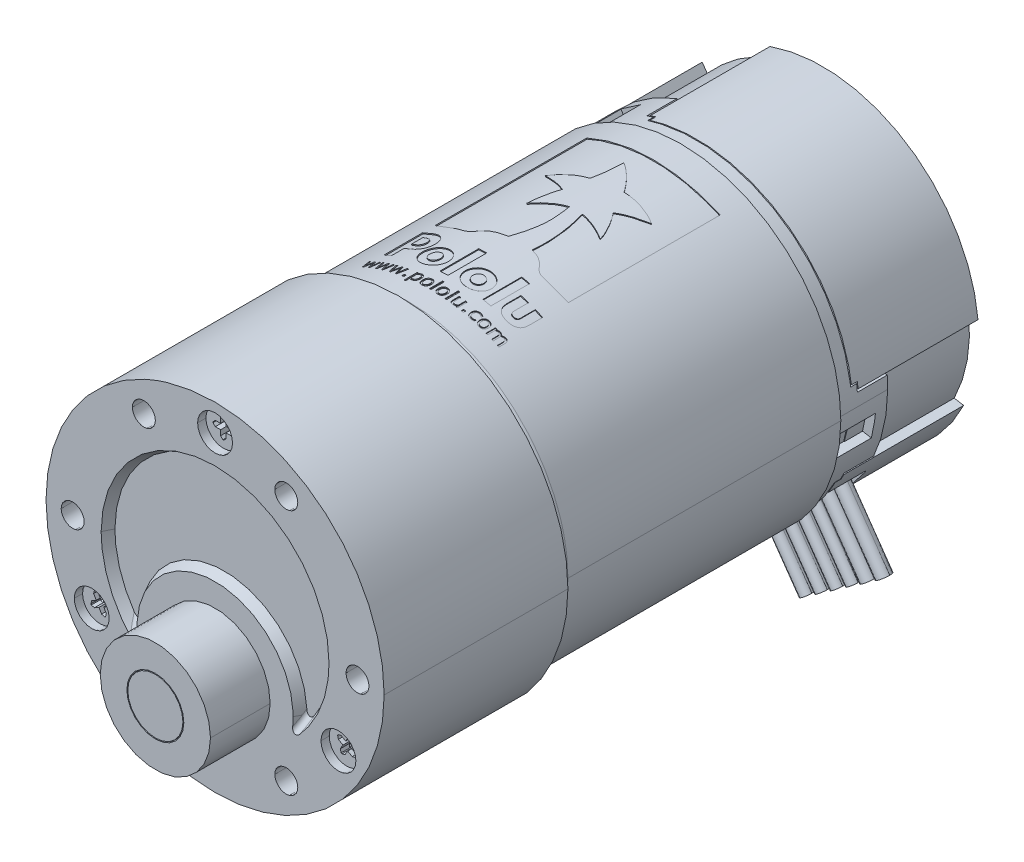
SolidWorks part; units mm, degrees
ref_plane "Plan de face" through (0, 0, 0) normal (0, 0, 1) x (1, 0, 0)
ref_plane "Plan de dessus" through (0, 0, 0) normal (0, 1, 0) x (1, 0, 0)
ref_plane "Plan de droite" through (0, 0, 0) normal (1, 0, 0) x (0, 0, -1)
imported_body "37d-gearmotor-6-10-encoder.step<1>"
sketch "Esquisse1" plane through (0, 0, 41.925) normal (0, 0, 1) x (1, 0, 0)
  circle A0 centre (19.925, -7) radius 3
extrude "Enlèv. mat.-Extru.1" cut sketch "Esquisse1" against normal up to surface (15.5 mm away)
